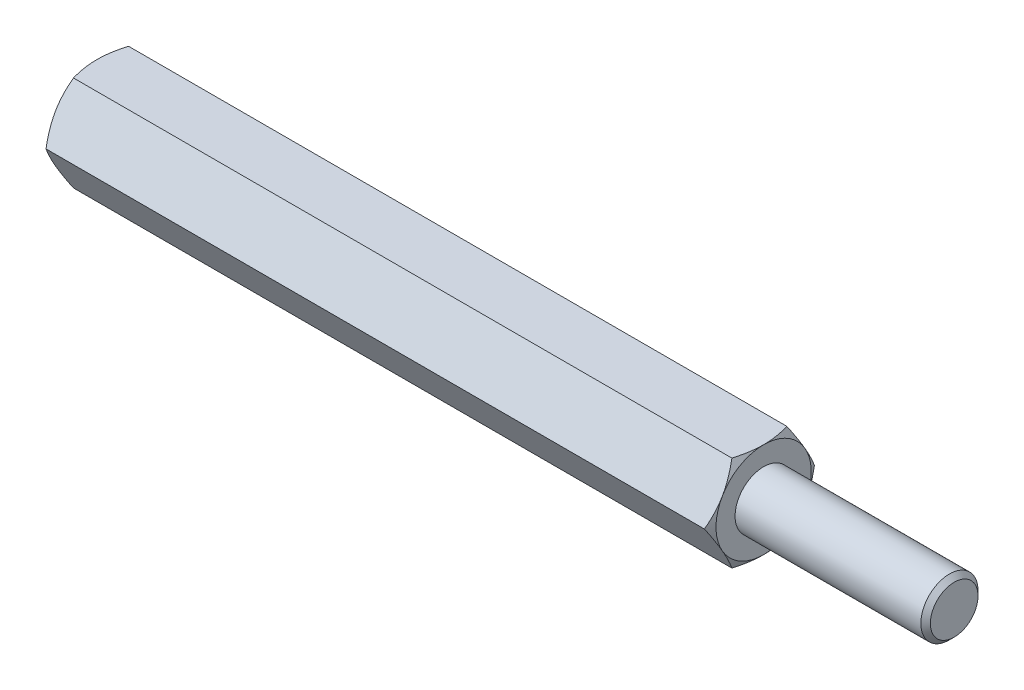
SolidWorks part; units mm, degrees
ref_plane "Front Plane" through (0, 0, 0) normal (0, 0, 1) x (1, 0, 0)
ref_plane "Top Plane" through (0, 0, 0) normal (0, 1, 0) x (1, 0, 0)
ref_plane "Right Plane" through (0, 0, 0) normal (1, 0, 0) x (0, 0, -1)
sketch "Sketch1" plane through (0, 0, 0) normal (1, 0, 0) x (0, 0, -1)
  line L1 (1.4434, 2.5) -> (-1.4434, 2.5)
  line L2 (-1.4434, 2.5) -> (-2.8868, 0)
  line L3 (-2.8868, 0) -> (-1.4434, -2.5)
  line L4 (-1.4434, -2.5) -> (1.4434, -2.5)
  line L5 (1.4434, -2.5) -> (2.8868, 0)
  line L6 (2.8868, 0) -> (1.4434, 2.5)
  circle A0 centre (0, 0) radius 2.5 construction
  dimension "D1" = 5
extrude "Extrude2" add sketch "Sketch1" along normal mid plane 35
sketch "Sketch2" plane through (0, 0, 0) normal (0, 0, 1) x (1, 0, 0)
  line L0 (-17.5, 2.5) -> (-16, 5.0981)
  line L1 (-17.5, 5.5) -> (-17.5, 2.5)
  line L3 (0, 0) -> (50000, 0) construction
  arc A0 (-16, 5.0981) -> (-17.5, 5.5) centre (-16.6962, 5.5) ccw
  dimension "D1" = 30
  dimension "D2" = 3
revolve "Cut-Revolve1" cut sketch "Sketch2" angle 360 about L3
mirror "Mirror1" about plane through (0, 0, 0) normal (1, 0, 0) of "Cut-Revolve1"
sketch "Sketch3" plane through (-17.5, 0, 0) normal (-1, 0, 0) x (0, 0, 1)
  circle A0 centre (0, 0) radius 1.25
  dimension "D1" = 2.5
extrude "Extrude3" cut sketch "Sketch3" against normal blind 10
sketch "Sketch4" plane through (0, 0, 0) normal (0, 0, 1) x (1, 0, 0)
  line L0 (-7.5, 0) -> (-7.5, 1.25)
  line L1 (17.2767, 0) -> (-17.2767, 0) construction
  line L2 (-7.5, 1.25) -> (-6.7783, 0)
  line L3 (-6.7783, 0) -> (-7.5, 0)
  line L4 (-17.5, 1.25) -> (-17.5, -1.25) construction
  point P4 (-17.5, 0)
  dimension "D1" = 30
  dimension "D2" = 1.25
  dimension "D3" = 10
revolve "Cut-Revolve2" cut sketch "Sketch4" angle 360 about L3
sketch "Sketch5" plane through (17.5, 0, 0) normal (1, 0, 0) x (0, 0, -1)
  circle A0 centre (0, 0) radius 1.5
  dimension "D1" = 3
extrude "Extrude4" add sketch "Sketch5" along normal blind 10
chamfer "Chamfer1" distance 0.25 angle 45 1 edges at (27.5, 0, -1.5)
equation "\"D2@Sketch4\" = \"D1@Sketch3\"/2"
